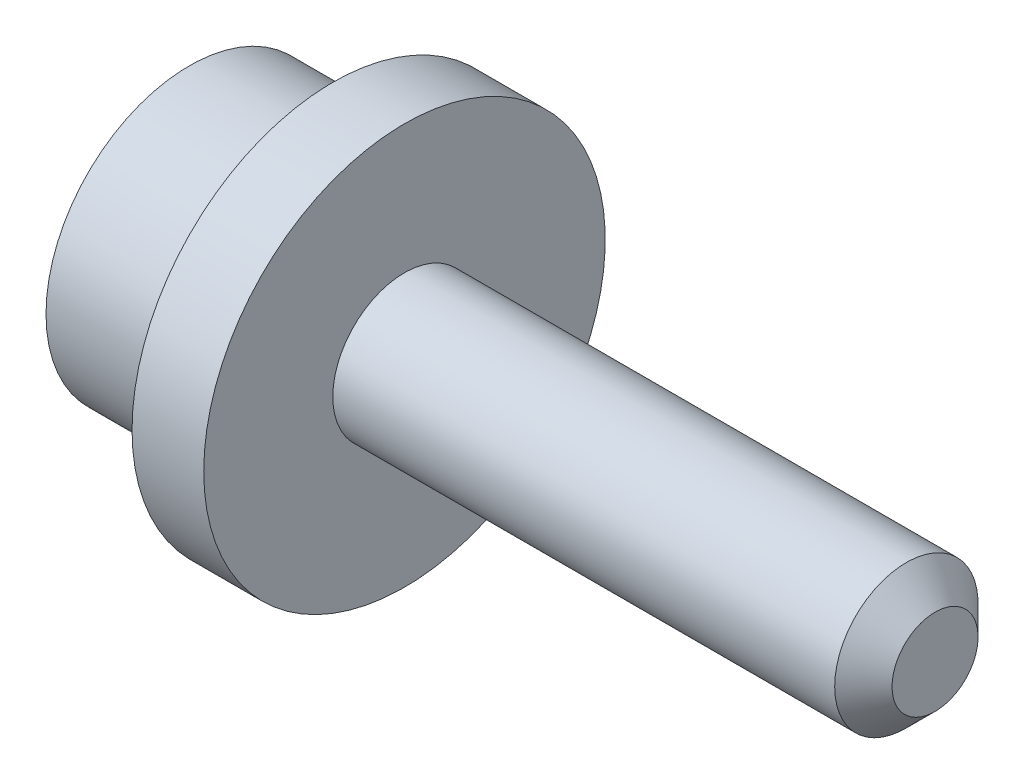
SolidWorks part; units mm, degrees
ref_plane "Plan de face" through (0, 0, 0) normal (0, 0, 1) x (1, 0, 0)
ref_plane "Plan de dessus" through (0, 0, 0) normal (0, 1, 0) x (1, 0, 0)
ref_plane "Plan de droite" through (0, 0, 0) normal (1, 0, 0) x (0, 0, -1)
sketch "Esquisse1" plane through (0, 0, 0) normal (0, 0, 1) x (1, 0, 0)
  line L0 (0, 1.5) -> (15, 1.5)
  line L1 (-19.1632, 0) -> (84.4478, 0) construction
  line L2 (7.5, 7) -> (5, 7)
  line L3 (5, 7) -> (5, 5)
  line L4 (5, 5) -> (0, 5)
  line L5 (0, 5) -> (0, 1.5)
  line L6 (15, 1.5) -> (15, 0)
  line L7 (15, 0) -> (26, 0)
  line L8 (26, 0) -> (26, 2.5)
  line L9 (26, 2.5) -> (7.5, 2.5)
  line L10 (7.5, 2.5) -> (7.5, 7)
  dimension "D1" = 2.5
  dimension "D2" = 1.5
  dimension "D3" = 5
  dimension "D4" = 7
  dimension "D5" = 5
  dimension "D6" = 7.5
  dimension "D7" = 26
  dimension "D8" = 15
revolve "Révolution1" add sketch "Esquisse1" angle 360 about L1
chamfer "Chanfrein1" distance 1 angle 45 1 edges at (26, 0, 2.5)
